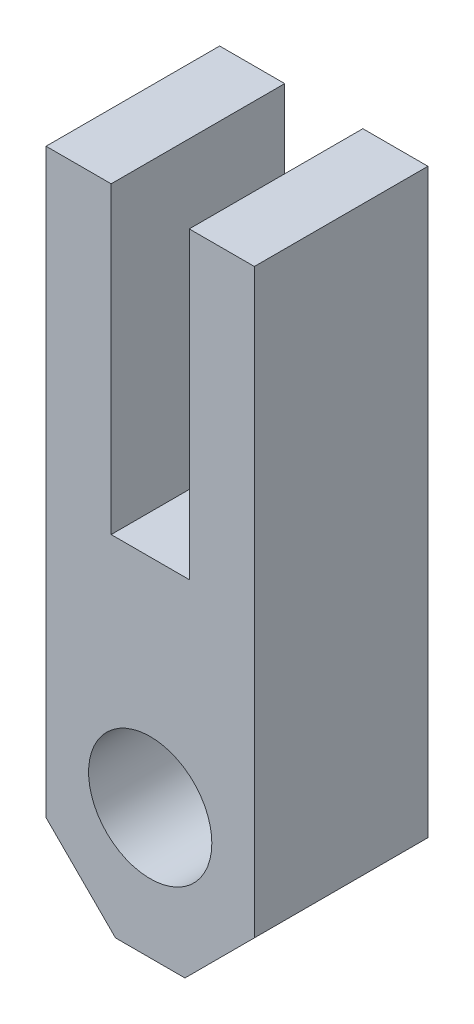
SolidWorks part; units mm, degrees
ref_plane "Plan de face" through (0, 0, 0) normal (0, 0, 1) x (1, 0, 0)
ref_plane "Plan de dessus" through (0, 0, 0) normal (0, 1, 0) x (1, 0, 0)
ref_plane "Plan de droite" through (0, 0, 0) normal (1, 0, 0) x (0, 0, -1)
sketch "Esquisse1" plane through (0, 0, 0) normal (0, 0, 1) x (1, 0, 0)
  line L0 (0, 0) -> (0, 52.2836) construction
  line L1 (4.5, 25) -> (-4.5, 25)
  line L2 (-4.5, 25) -> (-4.5, 60)
  line L3 (-4.5, 60) -> (-12, 60)
  line L4 (-12, 60) -> (-12, -7)
  line L5 (-12, -7) -> (-4, -15)
  line L6 (-4, -15) -> (4, -15)
  line L7 (0, 0) -> (0, -26.387) construction
  line L8 (12, -7) -> (4, -15)
  line L9 (12, 60) -> (12, -7)
  line L10 (4.5, 60) -> (12, 60)
  line L11 (4.5, 25) -> (4.5, 60)
  circle A0 centre (0, 0) radius 7.1
  point P13 (0, -15)
  point P17 (0, 25)
  dimension "D1" = 14.2
  dimension "D2" = 25
  dimension "D3" = 9
  dimension "D4" = 35
  dimension "D5" = 7.5
  dimension "D6" = 67
  dimension "D7" = 45
  dimension "D8" = 8
extrude "Extrusion1" add sketch "Esquisse1" along normal blind 20
